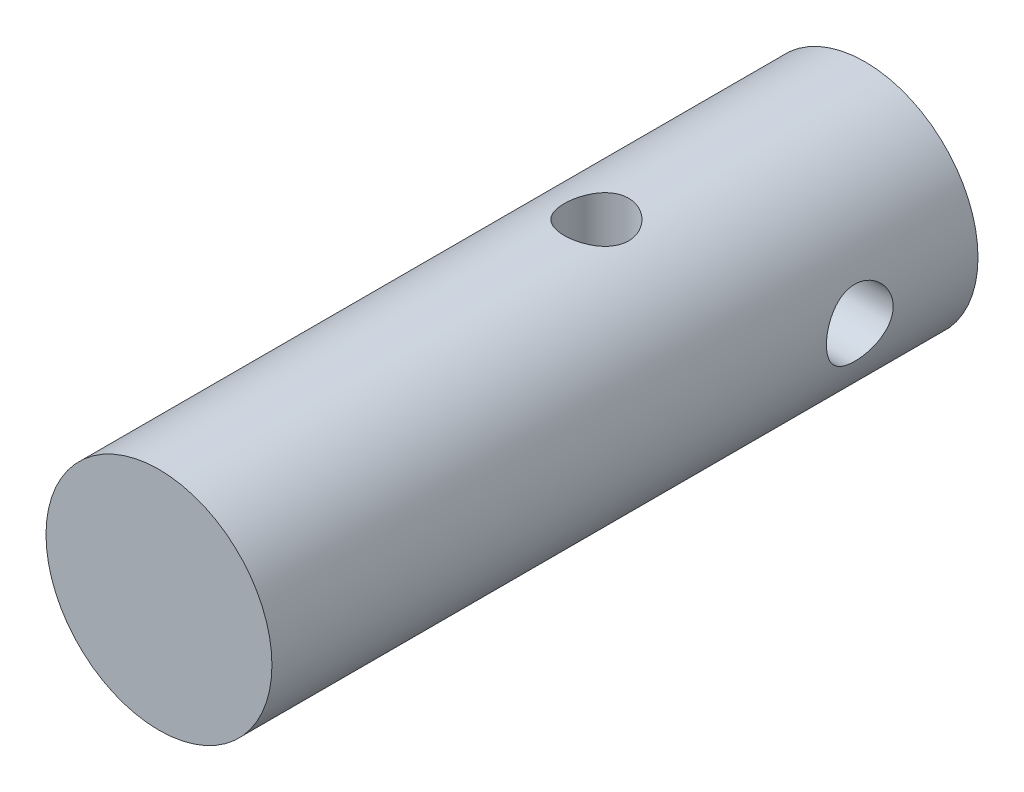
SolidWorks part; units mm, degrees
ref_plane "Front Plane" through (0, 0, 0) normal (0, 0, 1) x (1, 0, 0)
ref_plane "Top Plane" through (0, 0, 0) normal (0, 1, 0) x (1, 0, 0)
ref_plane "Right Plane" through (0, 0, 0) normal (1, 0, 0) x (0, 0, -1)
sketch "Sketch1" plane through (0, 0, 0) normal (0, 0, 1) x (1, 0, 0)
  circle A0 centre (0, 0) radius 5.08
  dimension "D1" = 10.16
extrude "Boss-Extrude1" add sketch "Sketch1" along normal blind 25.4 and the other way blind 6.35
sketch "Sketch2" plane through (0, 0, 0) normal (0, 1, 0) x (1, 0, 0)
  circle A0 centre (0, -5.73) radius 1.45
  dimension "D1" = 2.9
extrude "Cut-Extrude1" cut sketch "Sketch2" against normal through all both and the other way through all
ref_plane "Plane1" through (5.08, 0, 0) normal (1, 0, 0) x (0, 0, -1)
sketch "Sketch3" plane through (5.08, 0, 0) normal (1, 0, 0) x (0, 0, -1)
  line L0 (-4.28, 5.08) -> (-4.28, -5.08) construction
  line L1 (-4.28, 0) -> (6.35, 0) construction
  line L2 (6.35, -5.08) -> (6.35, 5.08) construction
  circle A1 centre (1.035, 0) radius 1.5
  dimension "D1" = 3
extrude "Cut-Extrude2" cut sketch "Sketch3" against normal through all and the other way through all
ref_plane "Plane2" through (-5.08, 0, 0) normal (1, 0, 0) x (0, 0, -1)
sketch "Sketch8" plane through (-5.08, 0, 0) normal (1, 0, 0) x (0, 0, -1)
  line L0 (0, 0) -> (-25.4, 0) construction
  line L1 (-25.4, 5.08) -> (-25.4, -5.08) construction
  circle A0 centre (-22.86, 0) radius 1.5
  dimension "D1" = 3
  dimension "D2" = 2.54
extrude "Cut-Extrude5" cut sketch "Sketch8" along normal blind 5.08
